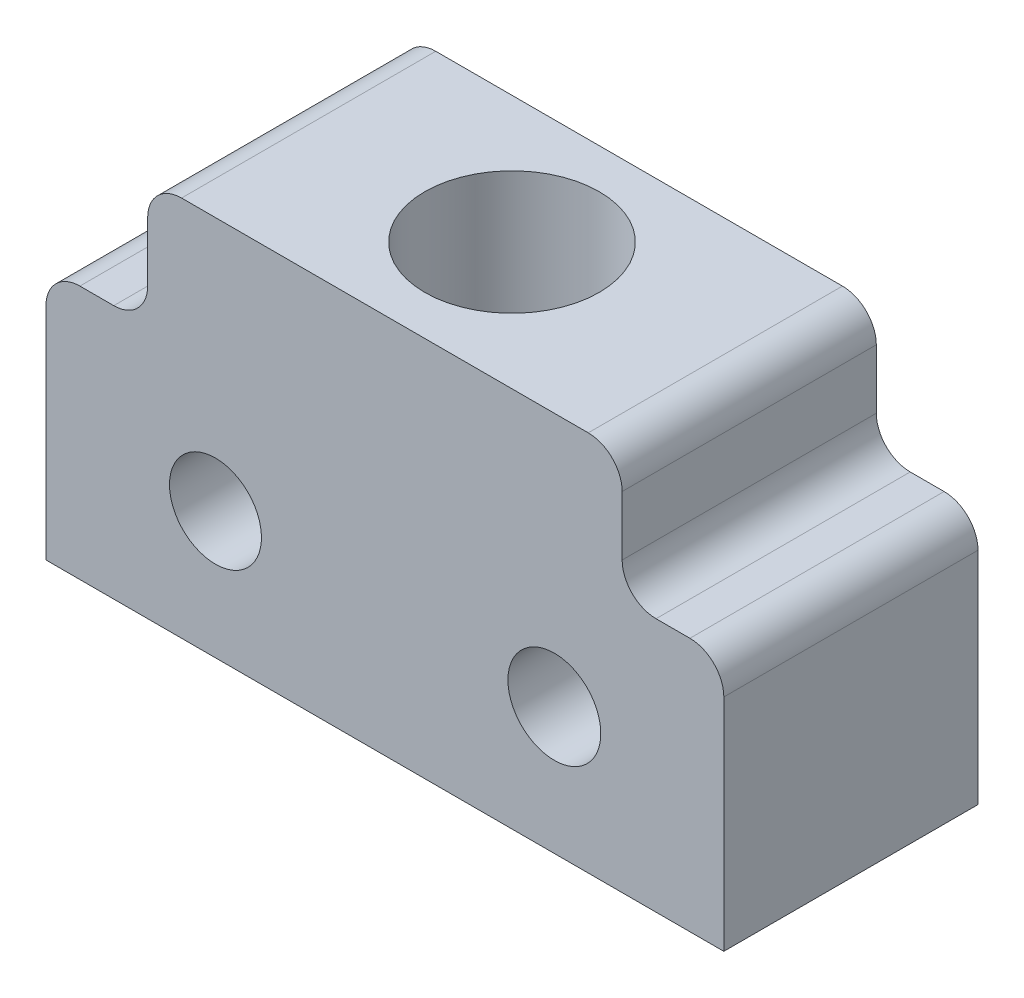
SolidWorks part; units mm, degrees
ref_plane "Front Plane" through (0, 0, 0) normal (0, 0, 1) x (1, 0, 0)
ref_plane "Top Plane" through (0, 0, 0) normal (0, 1, 0) x (1, 0, 0)
ref_plane "Right Plane" through (0, 0, 0) normal (1, 0, 0) x (0, 0, -1)
sketch "Sketch1" plane through (0, 0, 0) normal (0, 0, 1) x (1, 0, 0)
  line L1 (0, 0) -> (50.8, 0)
  line L2 (0, 0) -> (0, 19.05)
  line L3 (0, 19.05) -> (50.8, 19.05)
  line L4 (50.8, 0) -> (50.8, 19.05)
extrude "Boss-Extrude1" add sketch "Sketch1" along normal blind 19.05
sketch "Sketch3" plane through (0, 0, 19.05) normal (0, 0, 1) x (1, 0, 0)
  circle A0 centre (12.7, 9.525) radius 3.175
extrude "Cut-Extrude1" cut sketch "Sketch3" against normal through all
sketch "Sketch4" plane through (0, 0, 19.05) normal (0, 0, 1) x (1, 0, 0)
  circle A0 centre (38.1, 9.525) radius 3.1302
extrude "Cut-Extrude3" cut sketch "Sketch4" against normal through all
sketch "Sketch6" plane through (0, 19.05, 0) normal (0, 1, 0) x (1, 0, 0)
  line L0 (50.8, 0) -> (0, 0) construction
  line L1 (7.62, 0) -> (43.18, 0)
  line L2 (7.62, 0) -> (7.62, -19.05)
  line L3 (7.62, -19.05) -> (43.18, -19.05)
  line L4 (43.18, 0) -> (43.18, -19.05)
  line L5 (50.8, -19.05) -> (0, -19.05) construction
extrude "Boss-Extrude2" add sketch "Sketch6" along normal blind 9.525
sketch "Sketch7" plane through (0, 0, 0) normal (0, 0, -1) x (-1, 0, 0)
  circle A0 centre (-38.1, 9.525) radius 3.4801
  circle A1 centre (-12.7, 9.525) radius 3.4467
extrude "Cut-Extrude4" cut sketch "Sketch7" against normal through all
sketch "Sketch8" plane through (0, 28.575, 0) normal (0, 1, 0) x (1, 0, 0)
  circle A0 centre (25.4, -9.525) radius 4.445
extrude "Cut-Extrude6" cut sketch "Sketch8" against normal blind 10.16
fillet "Fillet1" radius 2.54 3 edges at (7.62, 28.575, 9.525) (0, 19.05, 9.525) (7.62, 19.05, 9.525)
fillet "Fillet2" radius 2.54 3 edges at (50.8, 19.05, 9.525) (43.18, 19.05, 9.525) (43.18, 28.575, 9.525)
sketch "Sketch9" plane through (0, 28.575, 0) normal (0, 1, 0) x (1, 0, 0)
  circle A0 centre (25.4, -9.525) radius 6.35
  dimension "D1" = 12.7
extrude "Cut-Extrude8" cut sketch "Sketch9" against normal blind 12.192
sketch "Sketch10" plane through (0, 28.575, 0) normal (0, 1, 0) x (1, 0, 0)
  circle A0 centre (25.4, -9.525) radius 6.5405
  dimension "D1" = 13.081
extrude "Cut-Extrude9" cut sketch "Sketch10" against normal blind 10.668
